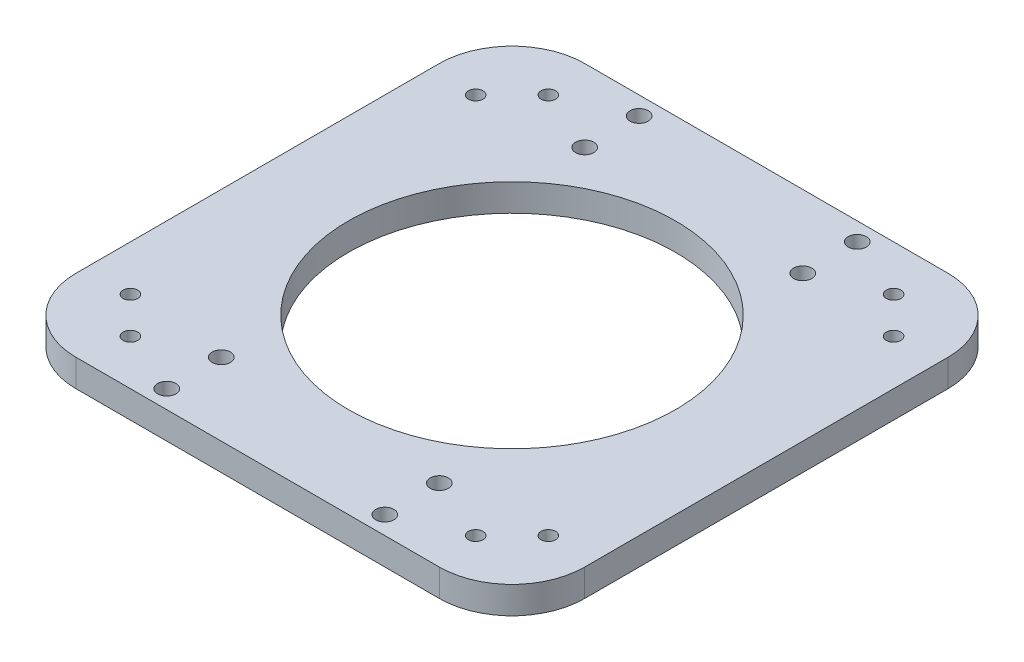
SolidWorks part; units mm, degrees
ref_plane "Front Plane" through (0, 0, 0) normal (0, 0, 1) x (1, 0, 0)
ref_plane "Top Plane" through (0, 0, 0) normal (0, 1, 0) x (1, 0, 0)
ref_plane "Right Plane" through (0, 0, 0) normal (1, 0, 0) x (0, 0, -1)
sketch "Sketch1" plane through (0, 0, 0) normal (0, 1, 0) x (1, 0, 0)
  line L1 (-88.9, 88.9) -> (88.9, 88.9)
  line L2 (-88.9, 88.9) -> (-88.9, -88.9)
  line L3 (-88.9, -88.9) -> (88.9, -88.9)
  line L4 (88.9, 88.9) -> (88.9, -88.9)
  line L5 (-88.9, 88.9) -> (88.9, -88.9) construction
  line L6 (-88.9, -88.9) -> (88.9, 88.9) construction
  point P0 (0, 0)
  dimension "D1" = 177.8
  dimension "D2" = 177.8
extrude "Boss-Extrude1" add sketch "Sketch1" along normal blind 9.525
sketch "Sketch2" plane through (0, 9.525, 0) normal (0, 1, 0) x (1, 0, 0)
  circle A0 centre (0, 0) radius 57.15
  dimension "D1" = 114.3
extrude "Cut-Extrude1" cut sketch "Sketch2" against normal blind 9.525
fillet "Fillet1" radius 25.4 4 edges at (-88.9, 4.7625, 88.9) (88.9, 4.7625, 88.9) (88.9, 4.7625, -88.9) (-88.9, 4.7625, -88.9)
sketch "Sketch3" plane through (0, 9.525, 0) normal (0, 1, 0) x (1, 0, 0)
  line L0 (95.7219, 82.55) -> (-96.4319, 82.55) construction
  line L1 (-96.4319, 63.5) -> (95.7219, 63.5) construction
  line L2 (88.9, 0) -> (-88.9, 0) construction
  line L3 (88.9, -63.5) -> (88.9, 63.5) construction
  line L4 (-88.9, 63.5) -> (-88.9, -63.5) construction
  line L6 (117.0529, 73.025) -> (-121.4829, 73.025) construction
  line L7 (0, 88.9) -> (0, -88.9) construction
  line L8 (63.5, 88.9) -> (-63.5, 88.9) construction
  line L9 (-63.5, -88.9) -> (63.5, -88.9) construction
  circle A0 centre (38.1, 82.55) radius 3.175
  circle A1 centre (38.1, 63.5) radius 3.175
  circle A2 centre (-38.1, 63.5) radius 3.175
  circle A3 centre (-38.1, 82.55) radius 3.175
  circle A4 centre (-38.1, -82.55) radius 3.175
  circle A5 centre (-38.1, -63.5) radius 3.175
  circle A6 centre (38.1, -63.5) radius 3.175
  circle A7 centre (38.1, -82.55) radius 3.175
  dimension "D4" = 6.35
  dimension "D5" = 38.1
  dimension "D1" = 9.525
  dimension "D2" = 9.525
  dimension "D3" = 73.025
extrude "Cut-Extrude2" cut sketch "Sketch3" against normal blind 6.35
sketch "Sketch4" plane through (0, 9.525, 0) normal (0, 1, 0) x (1, 0, 0)
  line L0 (114.5758, 0) -> (-112.4741, 0) construction
  line L1 (0, 123.3697) -> (0, -133.1308) construction
  line L2 (99.103, 73.025) -> (-120.2285, 73.025) construction
  circle A4 centre (60.325, 73.025) radius 2.5527
  circle A5 centre (-60.325, 73.025) radius 2.5527
  circle A6 centre (-60.325, -73.025) radius 2.5527
  circle A7 centre (60.325, -73.025) radius 2.5527
  dimension "D5" = 5.1054
  dimension "D6" = 60.325
  dimension "D4" = 73.025
extrude "Cut-Extrude3" cut sketch "Sketch4" against normal through all
sketch "Sketch5" plane through (0, 0, 0) normal (0, -1, 0) x (1, 0, 0)
  line L0 (-95.225, 0) -> (112.1365, 0) construction
  line L1 (0, 0) -> (0, 51.6307) construction
  line L2 (-82.55, 112.7962) -> (-82.55, -133.5537) construction
  line L3 (-63.5, 117.376) -> (-63.5, -133.5537) construction
  line L4 (-73.025, 112.7962) -> (-73.025, -133.5537) construction
  circle A1 centre (-82.55, 38.1) radius 3.175
  circle A4 centre (-63.5, 38.1) radius 3.175
  circle A5 centre (-63.5, -38.1) radius 3.175
  circle A6 centre (-82.55, -38.1) radius 3.175
  circle A7 centre (62.865, 38.1) radius 3.175
  circle A8 centre (62.865, -38.1) radius 3.175
  circle A9 centre (81.915, -38.1) radius 3.175
  circle A10 centre (81.915, 38.1) radius 3.175
  dimension "D4" = 6.35
  dimension "D1" = 9.525
  dimension "D2" = 9.525
  dimension "D3" = 73.025
  dimension "D5" = 38.1
extrude "Cut-Extrude4" cut sketch "Sketch5" against normal blind 6.35
sketch "Sketch6" plane through (0, 0, 0) normal (0, -1, 0) x (1, 0, 0)
  line L0 (0, 88.9) -> (0, -88.9) construction
  line L1 (-63.5, 88.9) -> (63.5, 88.9) construction
  line L2 (63.5, -88.9) -> (-63.5, -88.9) construction
  line L3 (-88.9, 0) -> (88.9, 0) construction
  line L4 (-88.9, -63.5) -> (-88.9, 63.5) construction
  line L5 (88.9, 63.5) -> (88.9, -63.5) construction
  line L6 (-73.025, -102.7205) -> (-73.025, 152.9417) construction
  circle A0 centre (-73.025, 60.325) radius 2.5527
  circle A1 centre (73.025, 60.325) radius 2.5527
  circle A2 centre (73.025, -60.325) radius 2.5527
  circle A3 centre (-73.025, -60.325) radius 2.5527
  dimension "D1" = 5.1054
  dimension "D2" = 60.325
  dimension "D4" = 73.025
extrude "Cut-Extrude5" cut sketch "Sketch6" against normal through all
